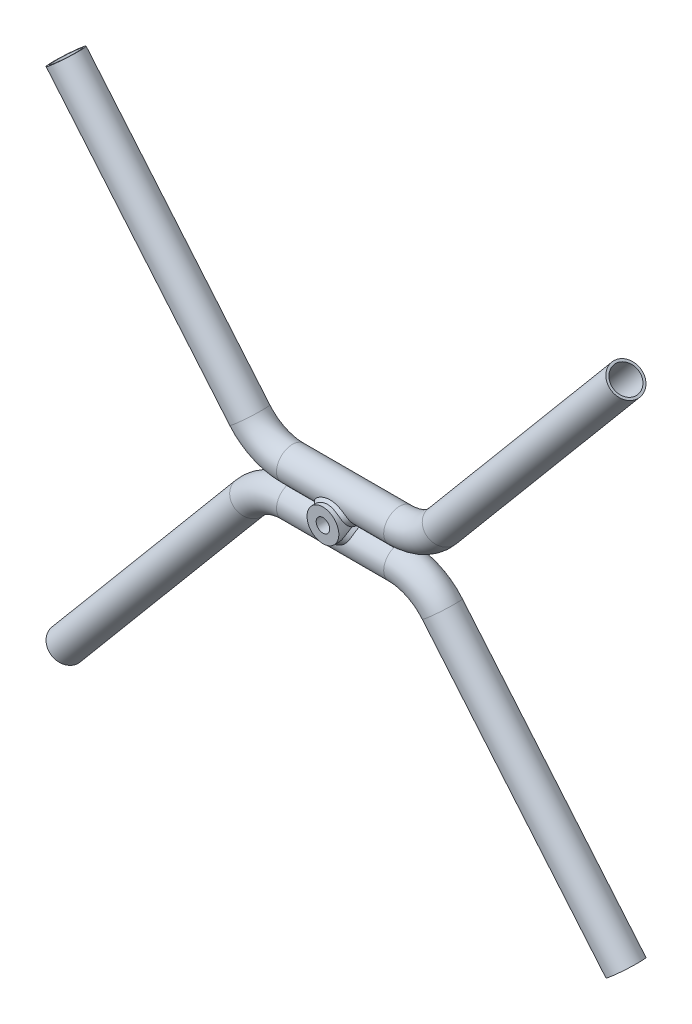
SolidWorks part; units mm, degrees
other "Detailelement1"
other "Detailelement14"
other "Detailelement15"
ref_plane "Ebene vorne" through (0, 0, 0) normal (0, 0, 1) x (1, 0, 0)
ref_plane "Ebene oben" through (0, 0, 0) normal (0, 1, 0) x (1, 0, 0)
ref_plane "Ebene rechts" through (0, 0, 0) normal (1, 0, 0) x (0, 0, -1)
sketch "Skizze1" plane through (0, 0, 0) normal (0, 0, 1) x (1, 0, 0)
  line L1 (0, 0) -> (-33.6792, 0)
  line L2 (-60.4908, -12.5024) -> (-175.8649, -150)
  line L3 (0, 34.0258) -> (0, -80.3148) construction
  arc A0 (-33.6792, 0) -> (-60.4908, -12.5024) centre (-33.6792, -35) ccw
  point P10 (-50, 0)
  point P13 (50, 0)
  dimension "D6" = 35
  dimension "D1" = 50
  dimension "D2" = 50
  dimension "D4" = 150
sketch "Skizze2" plane through (0, 0, 0) normal (1, 0, 0) x (0, 0, -1)
  circle A0 centre (0, 0) radius 10
  circle A1 centre (0, 0) radius 8.5
  dimension "D1" = 20
  dimension "D2" = 1.5
sweep "Austragung3" add profiles "Skizze2" path "Skizze1"
mirror "Spiegeln2" about plane through (0, 0, 0) normal (1, 0, 0) of "Austragung3"
ref_plane "Ebene1" through (0, 10, 0) normal (0, 1, 0) x (-1, 0, 0)
mirror "Spiegeln6" about plane through (0, 10, 0) normal (0, 1, 0)
other "Kehlnaht1" parameters "D10"=6, "D11"=50, "D12"=0, "D13"=3, "D14"=0
sketch "Skizze3" plane through (0, 0, 0) normal (0, 0, 1) x (1, 0, 0)
  line L0 (159.9965, 10) -> (-159.9965, 10) construction
  circle A0 centre (0, 10) radius 10
  dimension "D1" = 20
extrude "Linear austragen2" cut sketch "Skizze3" against normal through all and the other way through all
ref_plane "Ebene vorne-buchse" through (0, 10, -10.5) normal (1, 0, 0) x (0, 0, -1)
ref_plane "Ebene oben-buchse" through (0, 10, -10.5) normal (0, 1, 0) x (0, 0, -1)
ref_plane "Ebene rechts-buchse" through (0, 10, -10.5) normal (0, 0, -1) x (-1, 0, 0)
sketch "Skizze1-buchse" plane through (0, 10, -10.5) normal (0, 1, 0) x (0, 0, -1)
  line L0 (0, 0) -> (-83.7739, 0) construction
  line L1 (0, 10) -> (-25, 10)
  line L2 (-25, 10) -> (-25, 4.25)
  line L3 (-25, 4.25) -> (-15, 4.25)
  line L4 (-15, 4.25) -> (-15, 7)
  line L5 (-15, 7) -> (0, 7)
  line L6 (0, 7) -> (0, 10)
  dimension "D1" = 20
  dimension "D2" = 8.5
  dimension "D3" = 25
  dimension "D4" = 10
  dimension "D5" = 14
inserted part "buchse"
move or copy body "Körper-Verschieben/Kopieren2" placed by mates yes
other "Abstand2" parameters "D1"=10.5
other "<buchse>-<Fase1>"
other "Kehlnaht14" parameters "D10"=6, "D11"=2, "D12"=0, "D13"=3, "D14"=0
other "Kehlnaht15" parameters "D10"=6, "D11"=2, "D12"=0, "D13"=3, "D14"=0
